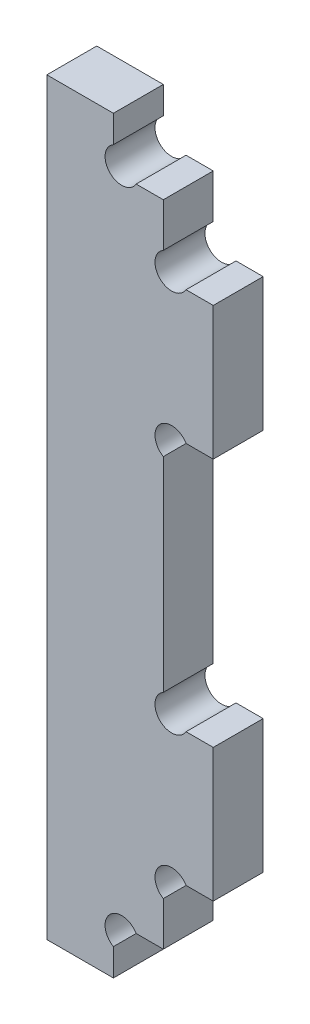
SolidWorks part; units mm, degrees
ref_plane "前视基准面" through (0, 0, 0) normal (0, 0, 1) x (1, 0, 0)
ref_plane "上视基准面" through (0, 0, 0) normal (0, 1, 0) x (1, 0, 0)
ref_plane "右视基准面" through (0, 0, 0) normal (1, 0, 0) x (0, 0, -1)
sketch "草图1" plane through (0, 0, 0) normal (0, 0, 1) x (1, 0, 0)
  line L1 (-3.5, -19.5) -> (3.5, -19.5)
  line L2 (-3.5, -19.5) -> (-3.5, 19.5)
  line L3 (-3.5, 19.5) -> (3.5, 19.5)
  line L4 (3.5, -19.5) -> (3.5, 19.5)
  line L5 (-3.5, -19.5) -> (3.5, 19.5) construction
  line L6 (-3.5, 19.5) -> (3.5, -19.5) construction
  point P0 (0, 0)
  dimension "D1" = 7
  dimension "D2" = 39
extrude "凸台-拉伸1" add sketch "草图1" along normal blind 3
sketch "草图2" plane through (0, 0, 0) normal (0, 0, 1) x (1, 0, 0)
  line L0 (-3.5, 0) -> (3.5, 0) construction
  line L1 (-3.5, 19.5) -> (0.5, 19.5)
  line L2 (-3.5, 19.5) -> (-3.5, 22.5)
  line L3 (-3.5, 22.5) -> (0.5, 22.5)
  line L4 (0.5, 19.5) -> (0.5, 22.5)
  line L5 (-3.5, -19.5) -> (0.5, -19.5)
  line L6 (-3.5, -19.5) -> (-3.5, -22.5)
  line L7 (-3.5, -22.5) -> (0.5, -22.5)
  line L8 (0.5, -19.5) -> (0.5, -22.5)
  line L9 (-3.5, 19.5) -> (-3.5, -19.5) construction
  line L10 (3.5, -19.5) -> (3.5, 19.5) construction
  line L11 (6.5, -15.5) -> (6.5, -7.5)
  line L12 (3.5, 15.5) -> (6.5, 15.5)
  line L13 (3.5, 15.5) -> (3.5, 7.5)
  line L14 (3.5, 7.5) -> (6.5, 7.5)
  line L15 (6.5, 15.5) -> (6.5, 7.5)
  line L16 (3.5, -7.5) -> (6.5, -7.5)
  line L17 (3.5, -15.5) -> (3.5, -7.5)
  line L18 (3.5, -15.5) -> (6.5, -15.5)
  dimension "D1" = 3
  dimension "D2" = 4
  dimension "D3" = 3
  dimension "D4" = 8
  dimension "D5" = 15
extrude "凸台-拉伸2" add sketch "草图2" along normal blind 3
hole_wizard "Ø2.0 (2) 直径孔1" positions "草图3" profile "草图4" hole size "Ø2.0" standard "GB"
sketch "草图3" plane through (0, 0, 3) normal (0, 0, 1) x (1, 0, 0)
  line L0 (3.5, 19.5) -> (0.5, 19.5) construction
  line L2 (0.5, 19.5) -> (0.5, 22.5) construction
  line L3 (6.5, 11.5) -> (-3.5, 11.5) construction
  line L4 (6.5, 7.5) -> (6.5, 15.5) construction
  line L5 (-3.5, 22.5) -> (-3.5, -22.5) construction
  line L6 (6.5, 15.5) -> (3.5, 15.5) construction
  line L7 (3.5, 15.5) -> (3.5, 19.5) construction
  line L8 (-3.5, 0) -> (3.5, 0) construction
  line L9 (3.5, -7.5) -> (3.5, 7.5) construction
  point P0 (1, 20)
  point P22 (4, 16)
  point P30 (4, 7)
  point P37 (1, -20)
  point P38 (4, -7)
  point P39 (4, -16)
  dimension "D1" = 0.5
  dimension "D2" = 0.5
  dimension "D3" = 0.5
  dimension "D4" = 0.5
sketch "草图4" plane through (1, 20, 3) normal (1, 0, 0) x (0, -1, 0)
  line L0 (0, 0) -> (0, 3)
  line L1 (0, 3) -> (1, 3)
  line L2 (1, 3) -> (1, 0)
  line L5 (1, 0) -> (0, 0)
  line L11 (0, -6.35) -> (0, 107.95) construction
  dimension "通孔孔直径" = 2
  dimension "通孔孔深度" = 3
